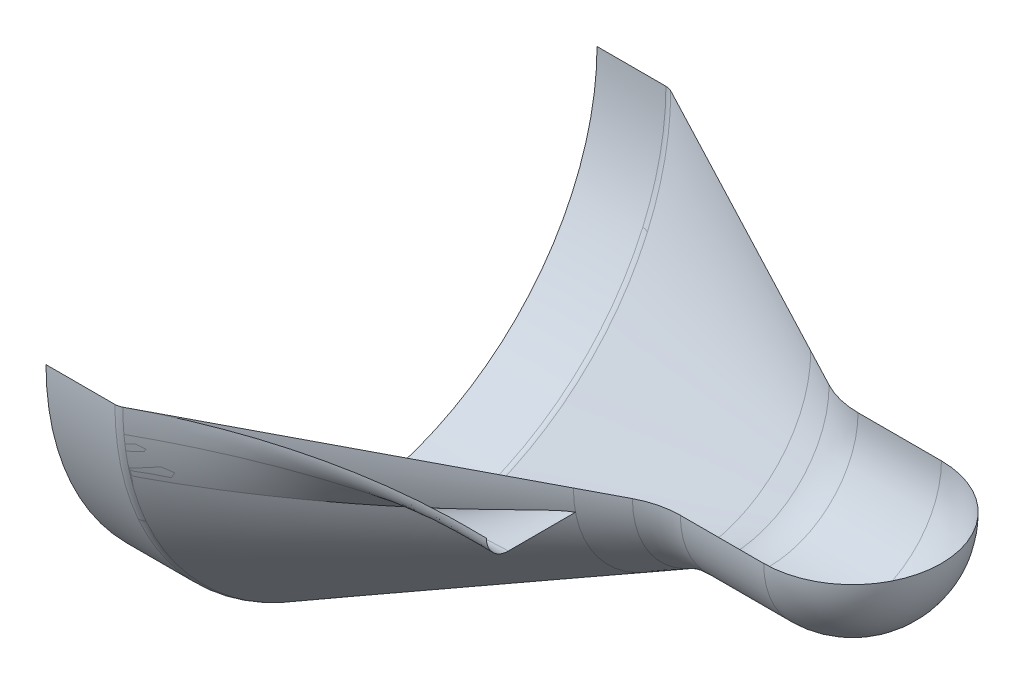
SolidWorks part; units mm, degrees
ref_plane "Vorne" through (0, 0, 0) normal (0, 0, 1) x (1, 0, 0)
ref_plane "Oben" through (0, 0, 0) normal (0, 1, 0) x (1, 0, 0)
ref_plane "Rechts" through (0, 0, 0) normal (1, 0, 0) x (0, 0, -1)
sketch "Skizze1" plane through (0, 0, 0) normal (0, 1, 0) x (1, 0, 0)
  line L0 (0, 0) -> (770.7263, 0) construction
  line L1 (0, 200) -> (50, 200)
  line L2 (54.6536, 198.8512) -> (297.0781, 71.3929)
  line L3 (2, 198) -> (50, 198) construction
  line L4 (0, 198) -> (50, 198) construction
  line L5 (385.5, 64.5) -> (325, 64.5)
  line L6 (53.7229, 197.081) -> (296.1474, 69.6226) construction
  line L7 (385.5, 62.5) -> (325, 62.5) construction
  line L8 (0, 200) -> (0, 198) construction
  line L9 (448, 0) -> (450, 0) construction
  line L10 (385.5, 64.5) -> (385.5, 62.5) construction
  line L12 (0, 200) -> (0, 196.253) construction
  line L19 (2, 198) -> (2, 196.253) construction
  arc A0 (50, 200) -> (54.6536, 198.8512) centre (50, 190) cw
  arc A1 (50, 198) -> (53.7229, 197.081) centre (50, 190) cw construction
  arc A2 (325, 62.5) -> (296.1474, 69.6226) centre (325, 124.5) cw construction
  arc A3 (385.5, 62.5) -> (448, 0) centre (385.5, 0) cw construction
  arc A4 (325, 64.5) -> (297.0781, 71.3929) centre (325, 124.5) cw
  arc A8 (385.5, 64.5) -> (450, 0) centre (385.5, 0) cw
  point P14 (87.3818, 188.4588)
  point P15 (510.3654, -55.7509)
  dimension "D2" = 10
  dimension "D4" = 2
  dimension "D5" = 60
  dimension "D7" = 64.5
  dimension "D3" = 400
  dimension "D6" = 50
  dimension "D8" = 325
  dimension "D13" = 450
surface "Oberfläche-Rotation1" sketch "Skizze1" parameters "D1"=180
ref_plane "Ebene1" through (100, 0, 0) normal (1, 0, 0) x (0, 0, -1)
sketch "Skizze9" plane through (0, 0, 0) normal (0, 0, 1) x (1, 0, 0)
  line L0 (50, -80.3054) -> (54.6536, -80.3054)
  line L1 (50, -200) -> (50, 0) construction
  line L2 (54.6536, -198.8512) -> (54.6536, 0) construction
ref_plane "Ebene2" through (269, 0, 0) normal (1, 0, 0) x (0, 0, -1)
sketch "Skizze11" plane through (269, 0, 0) normal (1, 0, 0) x (0, 0, -1)
  line L0 (-49.3016, -16) -> (-133.3016, -16) construction
  line L2 (-49.3016, -16) -> (-133.3016, -16)
  arc A0 (-149.3016, 0) -> (-133.3016, -16) centre (-133.3016, 0) ccw construction
  arc A2 (-149.3016, 0) -> (-133.3016, -16) centre (-133.3016, 0) ccw
surface "Oberfläche-Ausformung2"
surface "Oberfläche-Trimmen2"
sketch "Skizze13" plane through (0, 0, 0) normal (0, 0, 1) x (1, 0, 0)
  line L0 (269, 0) -> (269, -141.9302)
